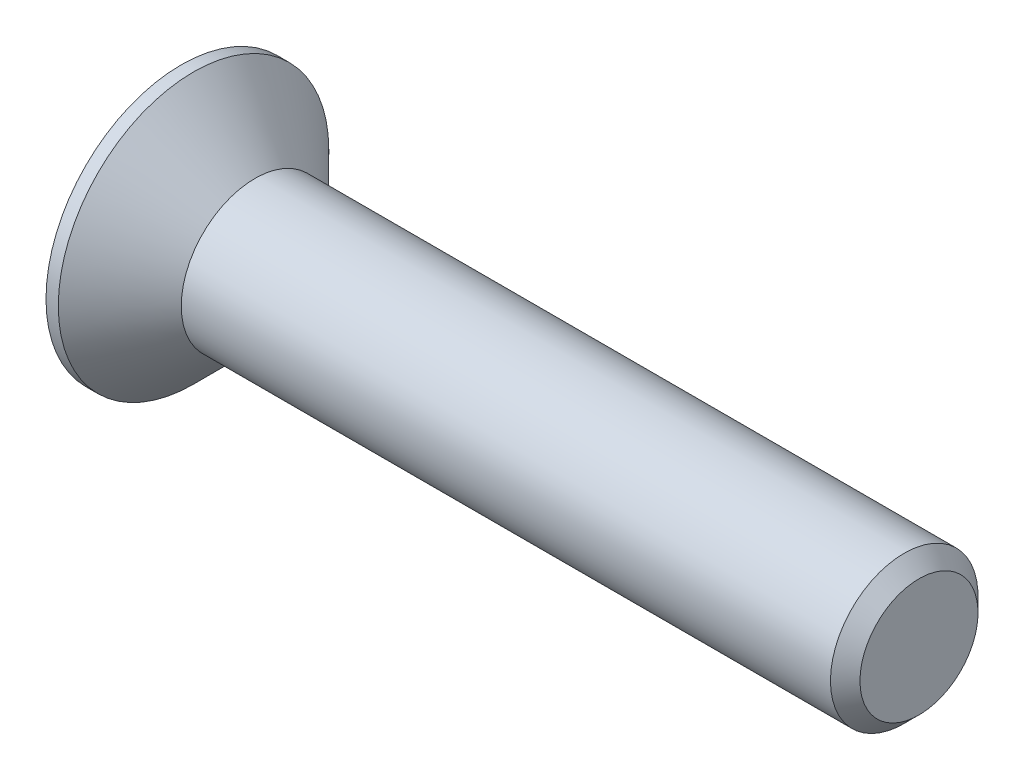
SolidWorks part; units mm, degrees
ref_plane "Front Plane" through (0, 0, 0) normal (0, 0, 1) x (1, 0, 0)
ref_plane "Top Plane" through (0, 0, 0) normal (0, 1, 0) x (1, 0, 0)
ref_plane "Right Plane" through (0, 0, 0) normal (1, 0, 0) x (0, 0, -1)
sketch "Sketch1" plane through (0, 0, 0) normal (0, 0, 1) x (1, 0, 0)
  line L1 (-3, 5.5) -> (-3, 0)
  line L2 (-3, 0) -> (27, 0)
  line L3 (27, 0) -> (27, 3)
  line L4 (27, 3) -> (0, 3)
  line L5 (-3, 5.5) -> (-2.5, 5.5)
  line L6 (-2.5, 5.5) -> (0, 3)
  dimension "D1" = 3
  dimension "D2" = 45
  dimension "D3" = 3
  dimension "D4" = 30
  dimension "D5" = 5.5
revolve "Revolve1" add sketch "Sketch1" angle 360 about L2
chamfer "Chamfer1" distance 0.6 angle 45 1 edges at (27, 0, 3)
sketch "Sketch2" plane through (-3, 0, 0) normal (-1, 0, 0) x (0, 0, 1)
  line L0 (-0.825, 3.3) -> (0.825, 3.3)
  line L1 (0.825, 3.3) -> (0.825, 0.825)
  line L2 (0.825, 0.825) -> (3.3, 0.825)
  line L3 (3.3, 0.825) -> (3.3, -0.825)
  line L4 (3.3, -0.825) -> (0.825, -0.825)
  line L5 (0.825, -0.825) -> (0.825, -3.3)
  line L6 (0.825, -3.3) -> (-0.825, -3.3)
  line L7 (-0.825, -3.3) -> (-0.825, -0.825)
  line L8 (-0.825, -0.825) -> (-3.3, -0.825)
  line L9 (-3.3, -0.825) -> (-3.3, 0.825)
  line L10 (-3.3, 0.825) -> (-0.825, 0.825)
  line L11 (-0.825, 0.825) -> (-0.825, 3.3)
  point P2 (0, 3.3)
  point P14 (0, -3.3)
  point P15 (3.3, 0)
  point P16 (-3.3, 0)
  dimension "D1" = 6.6
  dimension "D2" = 1.65
extrude "Cut-Extrude1" cut sketch "Sketch2" against normal blind 2.5
